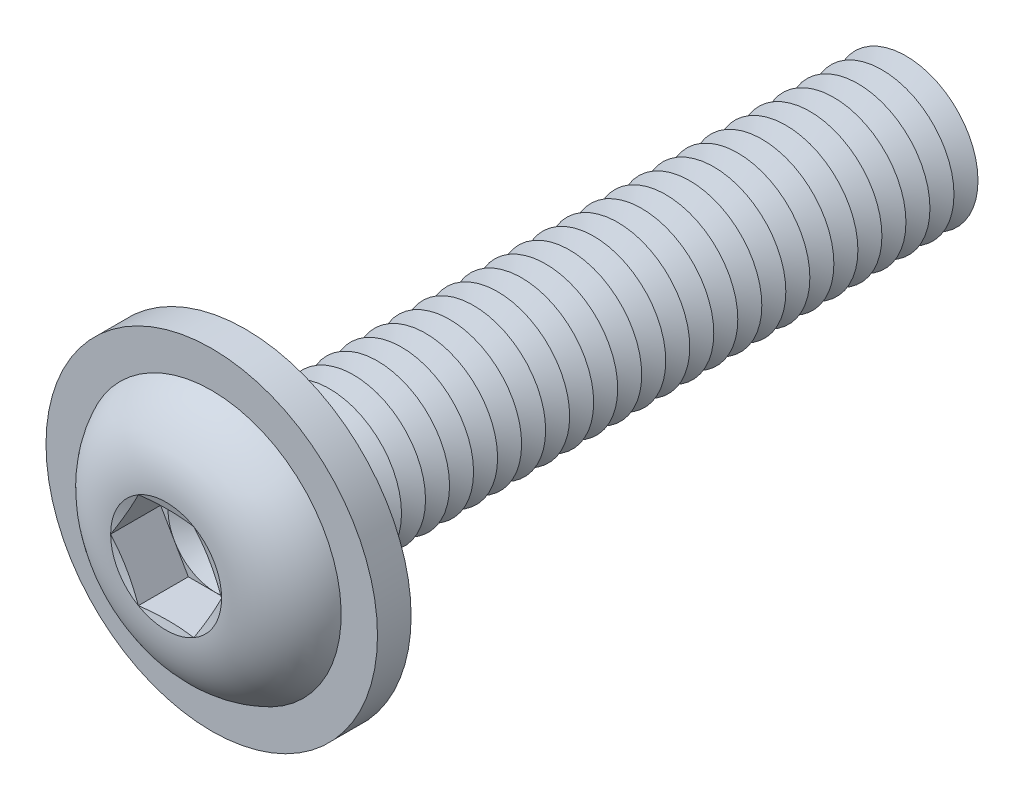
SolidWorks part; units mm, degrees
ref_plane "Front Plane" through (0, 0, 0) normal (0, 0, 1) x (1, 0, 0)
ref_plane "Top Plane" through (0, 0, 0) normal (0, 1, 0) x (1, 0, 0)
ref_plane "Right Plane" through (0, 0, 0) normal (1, 0, 0) x (0, 0, -1)
sketch "Sketch1" plane through (0, 0, 0) normal (1, 0, 0) x (0, 0, -1)
  line L0 (0, 1.5) -> (0, 2.85)
  line L3 (0, 1.5) -> (14, 1.5)
  line L4 (14, 1.5) -> (14, 0)
  line L5 (14, 0) -> (-1.65, 0) construction
  line L6 (-1.65, 0) -> (14, 0)
  line L7 (-1.65, 1.1547) -> (-1.65, 0.5773) construction
  line L8 (-1.65, 0.5773) -> (-1.65, 0)
  line L9 (-1.65, 1.1547) -> (-1.4953, 0.5773)
  line L10 (-1.4953, 0.5773) -> (-1.65, 0.5773)
  line L11 (14, 0) -> (22.7481, 0) construction
  line L12 (0, 2.85) -> (-1.65, 2.85) construction
  arc A1 (0, 2.85) -> (-1.65, 1.1547) centre (0, 1.1994) ccw
  point P8 (14, 0.75)
  dimension "D1" = 5.7
  dimension "D2" = 3
  dimension "D3" = 1.65
  dimension "D4" = 2.3094
  dimension "D5" = 14
  dimension "D6" = 15
revolve "Revolve1" add sketch "Sketch1" angle 360 about L5
fillet "Fillet1" radius 0.25 1 edges at (-1.5, 0, 0)
sketch "Sketch2" plane through (0, 0, 0) normal (1, 0, 0) x (0, 0, -1)
  line L0 (13.75, 1.5) -> (14.25, 1.5)
  line L1 (14, 1.5) -> (0.25, 1.5) construction
  line L2 (14.25, 1.5) -> (14, 1.067)
  line L3 (14, -1.5) -> (14, 1.5) construction
  line L4 (14, 1.067) -> (13.75, 1.5)
  dimension "D1" = 0.5
revolve "Cut-Revolve1" cut sketch "Sketch2" angle 360 about axis through (0, 0, -14) along (0, 0, -1)
pattern_linear "LPattern1" count 28 spacing 0.5 along (0, 0, 1) of "Cut-Revolve1"
sketch "Sketch3" plane through (0, 0, 1.65) normal (0, 0, 1) x (1, 0, 0)
  line L7 (0.5773, 1) -> (-0.5774, 1)
  line L8 (-0.5774, 1) -> (-1.1547, 0)
  line L9 (-1.1547, 0) -> (-0.5773, -1)
  line L10 (-0.5773, -1) -> (0.5773, -1)
  line L11 (0.5773, -1) -> (1.1547, 0)
  line L12 (1.1547, 0) -> (0.5773, 1)
  circle A0 centre (0, 0) radius 1 construction
  circle A3 centre (0, 0) radius 1.1547 construction
extrude "Cut-Extrude1" cut sketch "Sketch3" against normal blind 1.04
sketch "Sketch4" plane through (0, 0, 0.61) normal (0, 0, 1) x (1, 0, 0)
  line L1 (0.5773, 1) -> (-0.5774, 1) construction
  circle A0 centre (0, 0) radius 1
extrude "Cut-Extrude2" cut sketch "Sketch4" against normal through all draft 60
sketch "Sketch5" plane through (0, 0, 0) normal (0, 0, -1) x (-1, 0, 0)
  circle A0 centre (0, 0) radius 3.45
  circle A1 centre (0, 0) radius 1.75
  circle A2 centre (0, 0) radius 1.75 construction
  dimension "D1" = 6.9
extrude "Boss-Extrude1" add sketch "Sketch5" against normal blind 0.7
